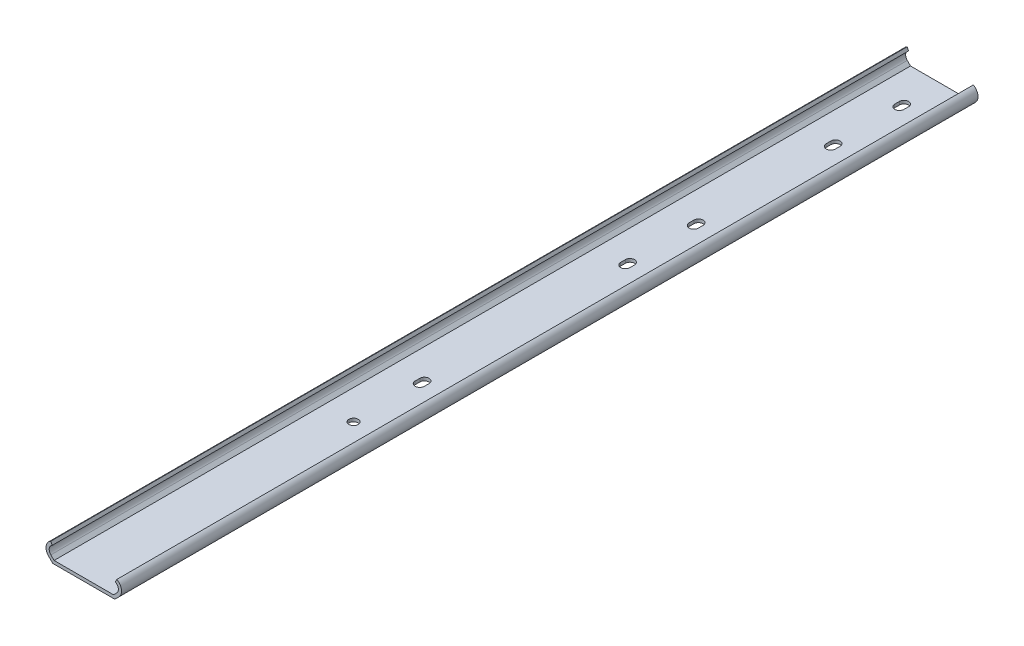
SolidWorks part; units mm, degrees
ref_plane "Vorne" through (0, 0, 0) normal (0, 0, 1) x (1, 0, 0)
ref_plane "Oben" through (0, 0, 0) normal (0, 1, 0) x (1, 0, 0)
ref_plane "Rechts" through (0, 0, 0) normal (1, 0, 0) x (0, 0, -1)
imported_body "Importiert1"
ref_plane "Ebene1" through (-14.0565, 2.0157, 150) normal (0, 0, -1) x (-1, 0, 0)
other "Fläche verschieben1"
